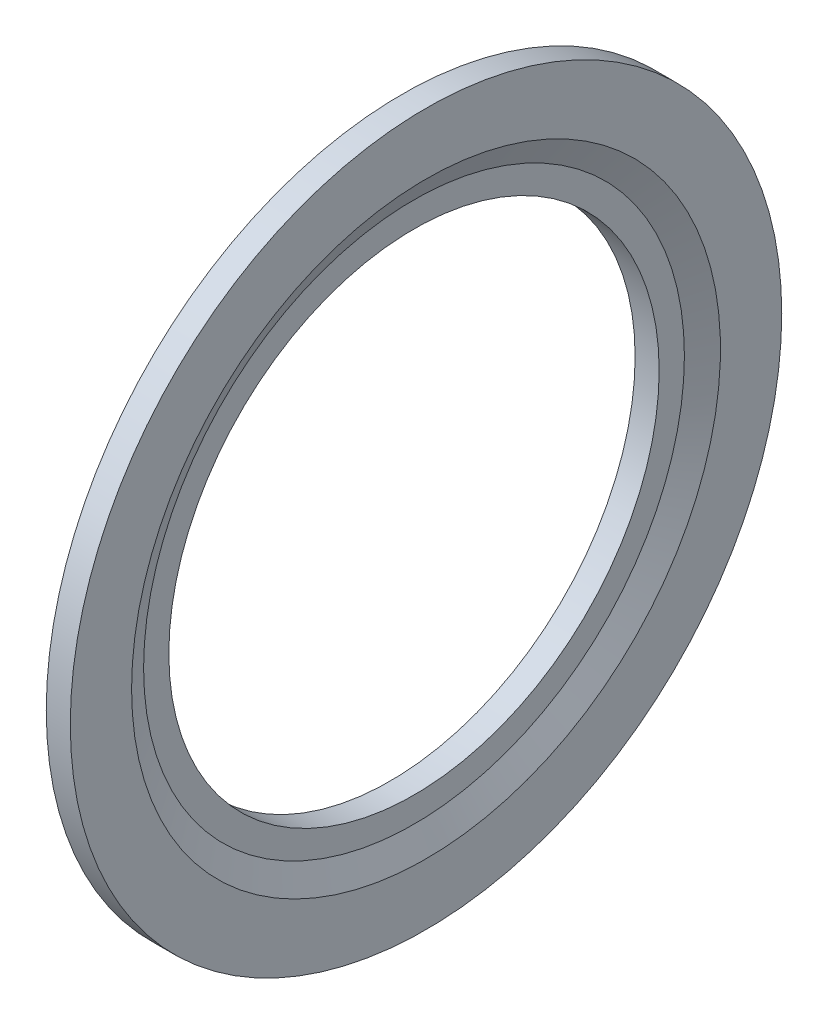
SolidWorks part; units mm, degrees
ref_plane "Plan1" through (0, 0, 0) normal (0, 0, 1) x (1, 0, 0)
ref_plane "Plan2" through (0, 0, 0) normal (0, 1, 0) x (1, 0, 0)
ref_plane "Plan3" through (0, 0, 0) normal (1, 0, 0) x (0, 0, -1)
sketch "Esquisse1" plane through (0, 0, 0) normal (0, 0, 1) x (1, 0, 0)
  line L0 (0, 12.75) -> (0, 10.2)
  line L1 (0, 10.2) -> (1, 10.2)
  line L2 (1, 10.2) -> (1, 12.25)
  line L3 (1, 12.25) -> (1.5, 12.25)
  line L4 (1.5, 12.25) -> (1.5, 14.8)
  line L5 (1.5, 14.8) -> (0.5, 14.8)
  line L6 (0.5, 14.8) -> (0.5, 12.75)
  line L7 (0.5, 12.75) -> (0, 12.75)
  line L8 (0, 0) -> (25.5203, 0) construction
  dimension "D1" = 20.4
  dimension "D2" = 24.5
  dimension "D3" = 29.6
  dimension "D4" = 1.5
  dimension "D5" = 0.5
  dimension "D6" = 1
  dimension "D7" = 25.5
revolve "Base-Révolution" add sketch "Esquisse1" angle 360 about L8
chamfer "Chanfrein1" distance 0.5 distance2 1
chamfer "Chanfrein2" distance 1 distance2 0.5
